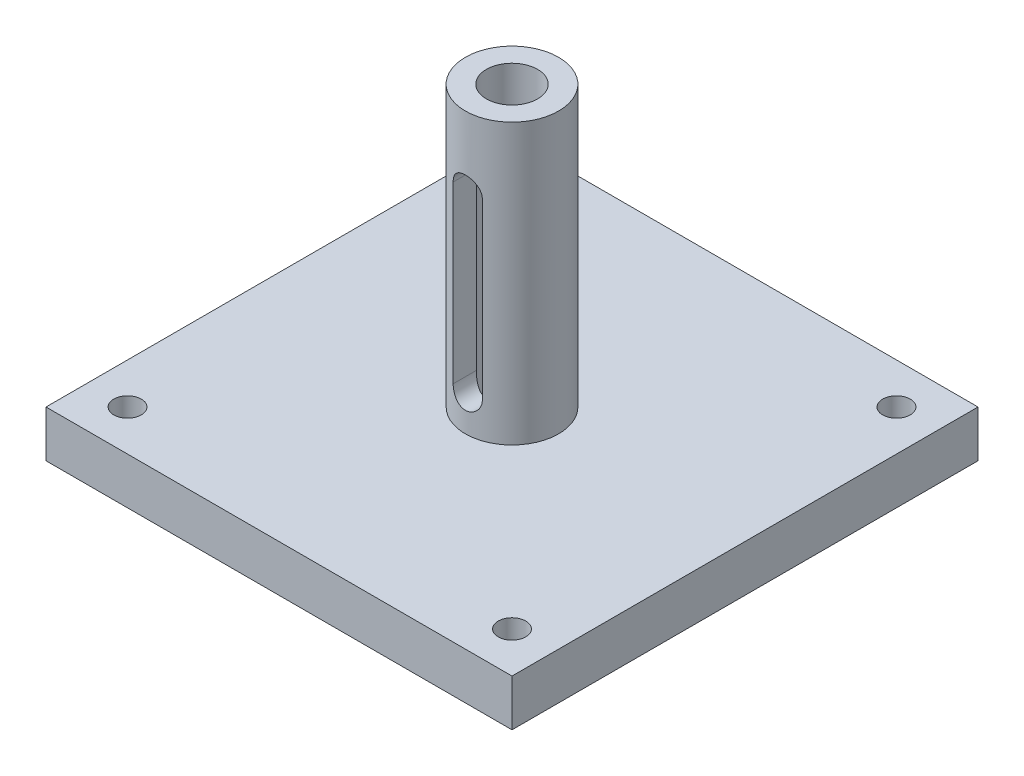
SolidWorks part; units mm, degrees
ref_plane "Front Plane" through (0, 0, 0) normal (0, 0, 1) x (1, 0, 0)
ref_plane "Top Plane" through (0, 0, 0) normal (0, 1, 0) x (1, 0, 0)
ref_plane "Right Plane" through (0, 0, 0) normal (1, 0, 0) x (0, 0, -1)
sketch "Sketch1" plane through (0, 0, 0) normal (0, 1, 0) x (1, 0, 0)
  line L1 (-25.4, -25.4) -> (25.4, -25.4)
  line L2 (-25.4, -25.4) -> (-25.4, 25.4)
  line L3 (-25.4, 25.4) -> (25.4, 25.4)
  line L4 (25.4, -25.4) -> (25.4, 25.4)
  line L5 (-25.4, -25.4) -> (25.4, 25.4) construction
  line L6 (-25.4, 25.4) -> (25.4, -25.4) construction
  point P0 (0, 0)
  dimension "D1" = 50.8
  dimension "D2" = 50.8
extrude "Boss-Extrude1" add sketch "Sketch1" along normal blind 5.08
sketch "Sketch2" plane through (0, 5.08, 0) normal (0, 1, 0) x (1, 0, 0)
  circle A0 centre (0, 0) radius 5.08
  circle A1 centre (0, 0) radius 2.794
  dimension "D1" = 10.16
  dimension "D2" = 2.286
extrude "Boss-Extrude2" add sketch "Sketch2" along normal blind 30.48
sketch "Sketch3" plane through (0, 0, 0) normal (0, 0, 1) x (1, 0, 0)
  line L0 (0, 5.08) -> (0, 35.56) construction
  line L1 (-25.4, 5.08) -> (25.4, 5.08) construction
  line L2 (5.08, 35.56) -> (-5.08, 35.56) construction
  line L3 (0, 27.94) -> (0, 8.89) construction
  line L4 (1.5875, 27.94) -> (1.5875, 8.89)
  line L5 (-1.5875, 27.94) -> (-1.5875, 8.89)
  arc A0 (1.5875, 27.94) -> (-1.5875, 27.94) centre (0, 27.94) ccw
  arc A1 (-1.5875, 8.89) -> (1.5875, 8.89) centre (0, 8.89) ccw
  point P8 (0, 18.415)
  dimension "D3" = 1.5875
  dimension "D1" = 7.62
  dimension "D2" = 3.81
extrude "Cut-Extrude1" cut sketch "Sketch3" against normal through all both and the other way through all
sketch "Sketch4" plane through (0, 5.08, 0) normal (0, 1, 0) x (1, 0, 0)
  circle A0 centre (0, 0) radius 1.5875
  dimension "D1" = 3.175
extrude "Cut-Extrude2" cut sketch "Sketch4" against normal through all
sketch "Sketch5" plane through (0, 5.08, 0) normal (0, 1, 0) x (1, 0, 0)
  line L1 (20.955, -20.955) -> (-20.955, -20.955) construction
  line L2 (20.955, -20.955) -> (20.955, 20.955) construction
  line L3 (20.955, 20.955) -> (-20.955, 20.955) construction
  line L4 (-20.955, -20.955) -> (-20.955, 20.955) construction
  line L5 (20.955, -20.955) -> (-20.955, 20.955) construction
  line L6 (20.955, 20.955) -> (-20.955, -20.955) construction
  circle A0 centre (-20.955, 20.955) radius 1.4999
  circle A1 centre (20.955, 20.955) radius 1.4999
  circle A2 centre (-20.955, -20.955) radius 1.4999
  circle A3 centre (20.955, -20.955) radius 1.4999
  point P0 (0, 0)
  dimension "D3" = 2.9997
  dimension "D1" = 41.91
  dimension "D2" = 41.91
extrude "Cut-Extrude3" cut sketch "Sketch5" against normal through all
